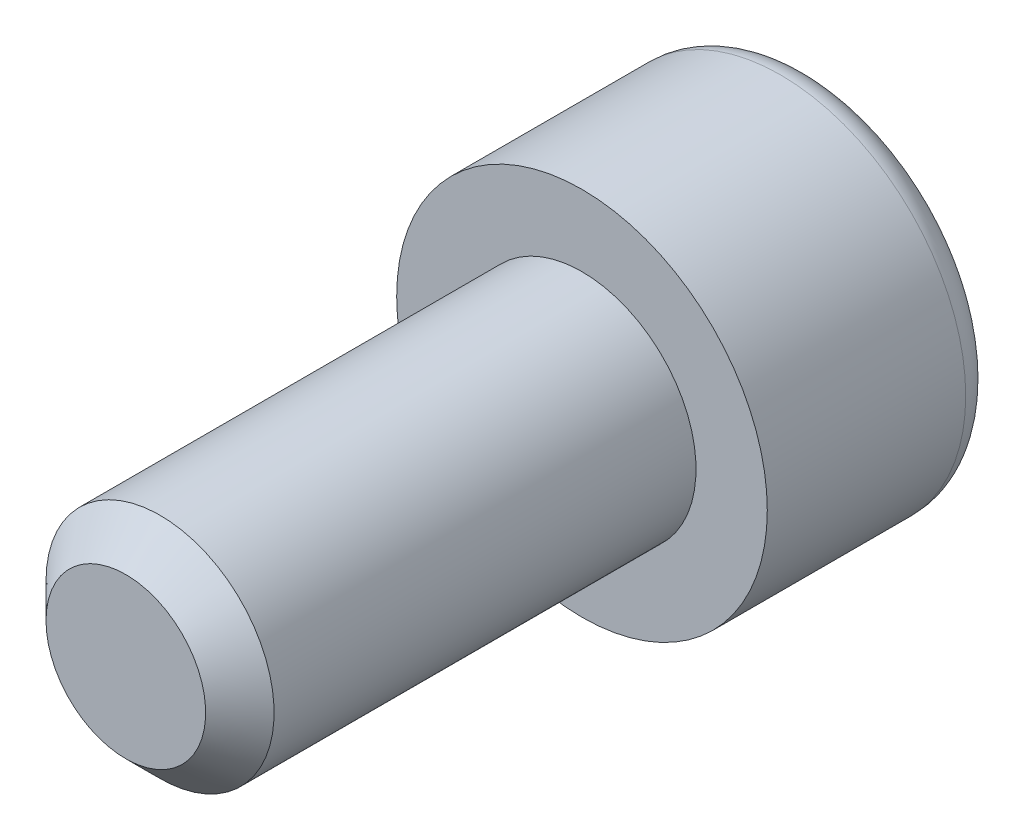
SolidWorks part; units mm, degrees
ref_plane "Plan1" through (0, 0, 0) normal (0, 0, 1) x (1, 0, 0)
ref_plane "Plan2" through (0, 0, 0) normal (0, 1, 0) x (1, 0, 0)
ref_plane "Plan3" through (0, 0, 0) normal (1, 0, 0) x (0, 0, -1)
sketch "Esquisse1" plane through (0, 0, 0) normal (0, 0, 1) x (1, 0, 0)
  circle A0 centre (0, 0) radius 4
extrude "Corps" add sketch "Esquisse1" along normal blind 16
sketch "Esquisse2" plane through (0, 0, 0) normal (0, 0, 1) x (1, 0, 0)
  circle A0 centre (0, 0) radius 6.5
extrude "Tete" add sketch "Esquisse2" against normal blind 8
ref_plane "Plan4" through (0, 0, -8) normal (0, 0, 1) x (1, 0, 0)
sketch "Esquisse3" plane through (0, 0, -8) normal (0, 0, 1) x (1, 0, 0)
  line L1 (0, -3.4641) -> (3, -1.7321)
  line L2 (3, -1.7321) -> (3, 1.7321)
  line L3 (3, 1.7321) -> (0, 3.4641)
  line L4 (0, 3.4641) -> (-3, 1.7321)
  line L5 (-3, 1.7321) -> (-3, -1.7321)
  line L6 (-3, -1.7321) -> (0, -3.4641)
  circle A0 centre (0, 0) radius 3 construction
  dimension "D1" = 6
extrude "6pans" cut sketch "Esquisse3" along normal blind 5.6
chamfer "Chanfrein2" distance 1.2 angle 45 1 edges at (4, 0, 16)
fillet "Congé1" radius 1.04 1 edges at (6.5, 0, -8)
equation "\"D1@Congé1\"=\"D1@Esquisse2\"*0.08"
equation "\"D1@Chanfrein2\"=\"D@Esquisse1\"*0.15"
equation "\"HT@6pans\"=\"HT@Tete\"*0.7"
equation "\"D1@Plan4\" = \"HT@Tete\""
